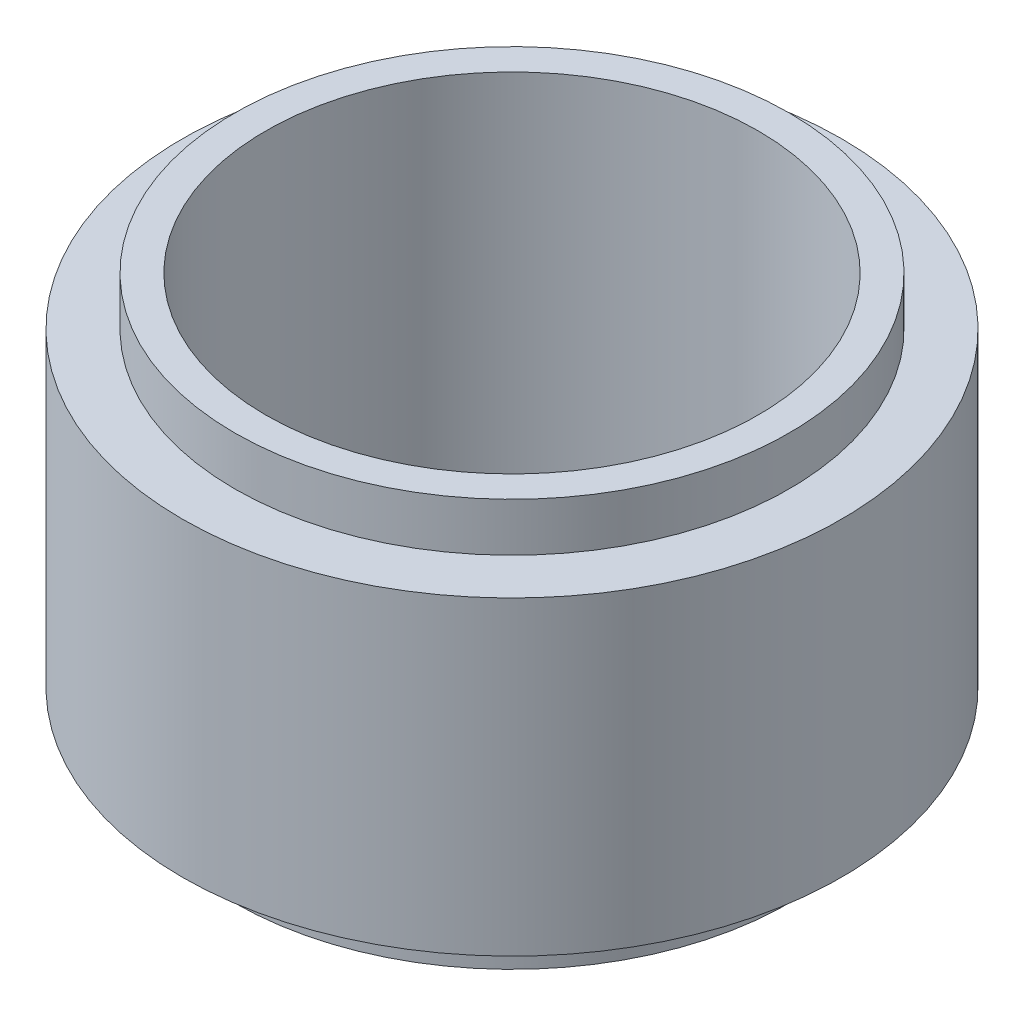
SolidWorks part; units mm, degrees
ref_plane "Plane1" through (0, 0, 0) normal (0, 0, 1) x (1, 0, 0)
ref_plane "Plane2" through (0, 0, 0) normal (0, 1, 0) x (1, 0, 0)
ref_plane "Plane3" through (0, 0, 0) normal (1, 0, 0) x (0, 0, -1)
sketch "Sketch1" plane through (0, 0, 0) normal (0, 0, 1) x (1, 0, 0)
  line L0 (0, 0) -> (0, 17.7062) construction
  line L1 (0, 0) -> (31.5137, 0) construction
  line L2 (7.15, 5.25) -> (7.15, 4)
  line L3 (8.5, 4) -> (8.5, -4)
  line L4 (8.5, -4) -> (7.15, -4)
  line L5 (8.5, 4) -> (7.15, 4)
  line L6 (7.15, 5.25) -> (6.35, 5.25)
  line L7 (7.15, -5.25) -> (6.35, -5.25)
  line L8 (6.35, 5.25) -> (6.35, -5.25)
  line L9 (7.15, -4) -> (7.15, -5.25)
  dimension "D1" = 8.5
  dimension "D2" = 0.8
  dimension "D3" = 6.35
  dimension "D4" = 10.5
  dimension "D5" = 8
revolve "Base-Revolve" add sketch "Sketch1" angle 360 about L0
sketch "Sketch2" plane through (0, 0, 0) normal (0, 0, 1) x (1, 0, 0)
  circle A0 centre (9.2222, 0) radius 2
  dimension "D1" = 4
extrude "Boss-Extrude1" [suppressed] add sketch "Sketch2" along normal mid plane 10
